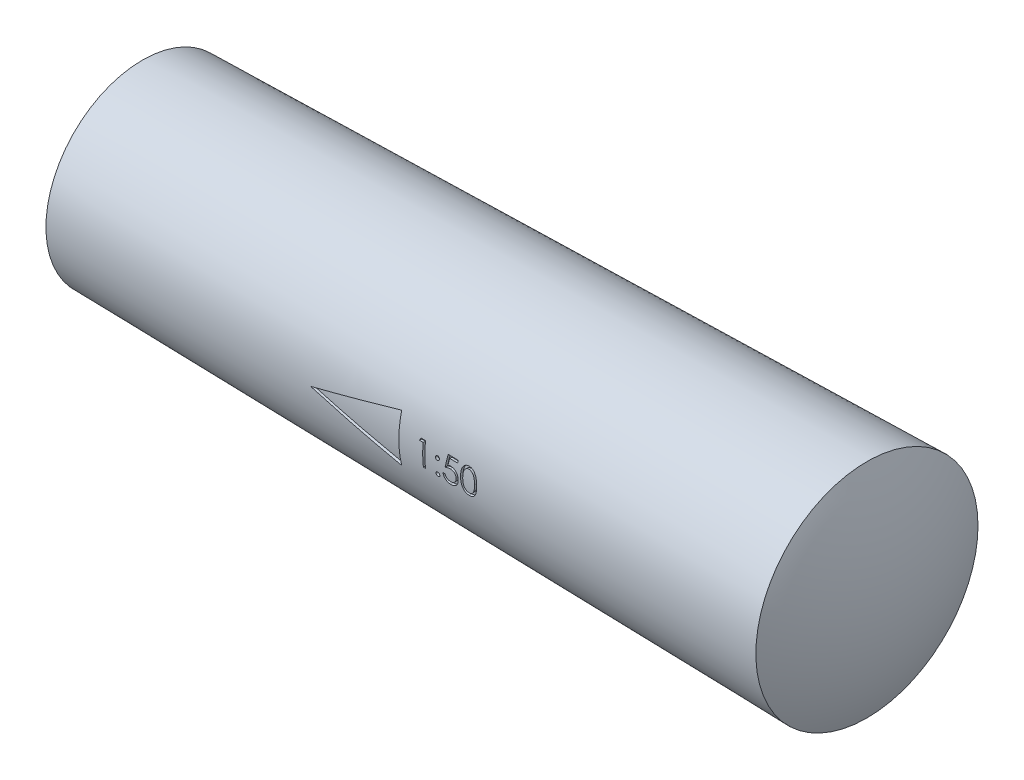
SolidWorks part; units mm, degrees
ref_plane "Front Plane" through (0, 0, 0) normal (0, 0, 1) x (1, 0, 0)
ref_plane "Top Plane" through (0, 0, 0) normal (0, 1, 0) x (1, 0, 0)
ref_plane "Right Plane" through (0, 0, 0) normal (1, 0, 0) x (0, 0, -1)
sketch "Sketch1" plane through (0, 0, 0) normal (1, 0, 0) x (0, 0, -1)
  circle A0 centre (0, 0) radius 4
  dimension "D1" = 8
extrude "Extrude1" add sketch "Sketch1" along normal mid plane 30
draft "Draft1" type of draft neutral plane draft angle 1.146 faces to draft 1 parameters "D1"=1.146
sketch "Sketch2" plane through (0, 0, 0) normal (0, 0, 1) x (1, 0, 0)
  line L0 (-15, 0) -> (-15, 4)
  line L1 (-15, 4) -> (-15, -4) construction
  line L2 (-15, 0) -> (-16, 0)
  line L3 (-16, 0) -> (-16, -4.3) construction
  line L4 (15, 0) -> (15, 4.6)
  line L5 (15, -4.6) -> (15, 4.6) construction
  line L6 (15, 0) -> (16, 0)
  line L7 (16, 0) -> (16, -4.3) construction
  line L8 (-15, -4) -> (15, -4.6) construction
  arc A0 (-16, 0) -> (-15, 4) centre (-7.5, 0) cw
  arc A1 (16, 0) -> (15, 4.6) centre (4.9199, 0) ccw
  point P14 (0, -4.3)
revolve "Revolve1" add sketch "Sketch2" angle 360 about L2
sketch "Sketch5" plane through (0, 0, 0) normal (0, 0, 1) x (1, 0, 0)
  line L0 (0, 4.3) -> (0, -4.3) construction
  line L1 (15, 4.6) -> (-15, 4) construction
  line L2 (-15, -4) -> (15, -4.6) construction
ref_plane "Plane2" through (0, 0, 0) normal (-0.02, 0, 0.9998) x (0.9998, 0, 0.02)
sketch "Sketch6" plane through (0, 0, 0) normal (-0.02, 0, 0.9998) x (0.9998, 0, 0.02)
  line L0 (0, 0) -> (0, 1)
  line L1 (0, 4.3) -> (0, -4.3) construction
  line L2 (0, 1) -> (-3.7321, 0)
  line L3 (-3.7321, 0) -> (0, -1)
  line L4 (0, -1) -> (0, 0)
  line L5 (0, -0.5) -> (4, -0.5) construction
  text T0 "1:50" font "Century Gothic" height 1
  dimension "D1" = 2
  dimension "D2" = 30
  dimension "D3" = 4
wrap "Wrap2" sketch "Sketch6" wrap type deboss source sketch "Sketch6" thickness 0.1 parameters "D1"=0.1
equation "\"D2@Sketch2\" = \"D1@Sketch2\""
